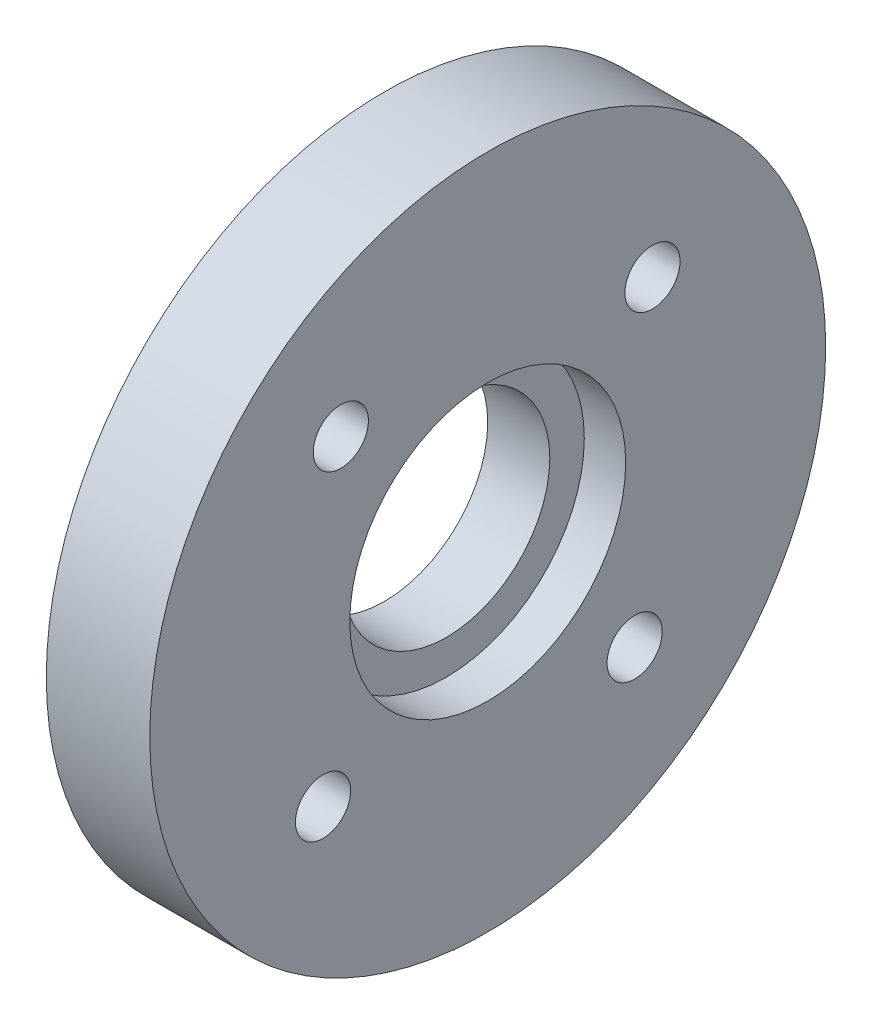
SolidWorks part; units mm, degrees
ref_plane "Plan de face" through (0, 0, 0) normal (0, 0, 1) x (1, 0, 0)
ref_plane "Plan de dessus" through (0, 0, 0) normal (0, 1, 0) x (1, 0, 0)
ref_plane "Plan de droite" through (0, 0, 0) normal (1, 0, 0) x (0, 0, -1)
sketch "Esquisse1" plane through (0, 0, 0) normal (0, 0, 1) x (1, 0, 0)
  line L0 (-6.733, 0) -> (30.9776, 0) construction
  line L1 (0, 49) -> (15, 49)
  line L2 (15, 49) -> (15, 20)
  line L3 (15, 20) -> (9, 20)
  line L4 (9, 20) -> (9, 15)
  line L5 (9, 15) -> (0, 15)
  line L6 (0, 15) -> (0, 49)
  dimension "D1" = 9
  dimension "D2" = 15
  dimension "D3" = 49
  dimension "D4" = 15
  dimension "D5" = 20
revolve "Révolution1" add sketch "Esquisse1" angle 360 about L0
hole_wizard "Trou taraudé M8x1.251" positions "Esquisse3" profile "Esquisse2" tap size "M8x1.25" standard "ISO"
sketch "Esquisse3" plane through (15, 0, 0) normal (1, 0, 0) x (0, 0, -1)
  point P0 (-23.8825, -21.2984)
  dimension "D1" = 32
sketch "Esquisse2" plane through (15, -21.2984, 23.8825) normal (0, 1, 0) x (0, 0, -1)
  line L0 (0, 0) -> (0, 25.7929)
  line L1 (0, 25.7929) -> (3.4, 23.75)
  line L2 (3.4, 23.75) -> (3.4, 20)
  line L3 (3.4, 20) -> (4, 20)
  line L4 (4, 20) -> (4, 0)
  line L5 (4, 0) -> (0, 0)
  line L10 (0, 25.7929) -> (-3.4, 23.75) construction
  line L11 (0, -6.35) -> (0, 107.95) construction
  dimension "Diamètre du trou pour taraudage" = 6.8
  dimension "Profondeur du trou pour taraudage" = 23.75
  dimension "Diamètre principal du filetage" = 8
  dimension "Profondeur du filetage" = 20
  dimension "Angle de pointe" = 118
pattern_circular "Répétition circulaire1" count 4 over 360 about axis through (0, 0, 0) along (1, 0, 0) of "Trou taraudé M8x1.251"
